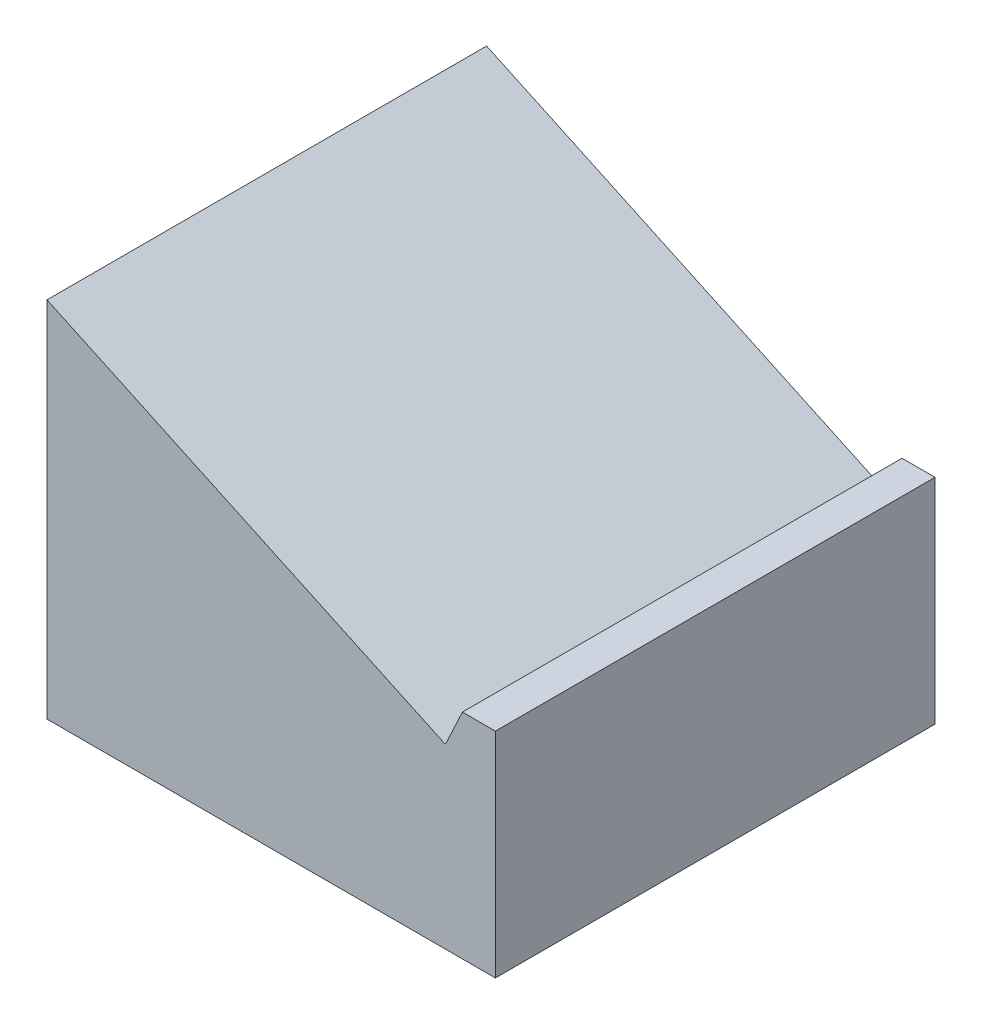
SolidWorks part; units mm, degrees
ref_plane "Front Plane" through (0, 0, 0) normal (0, 0, 1) x (1, 0, 0)
ref_plane "Top Plane" through (0, 0, 0) normal (0, 1, 0) x (1, 0, 0)
ref_plane "Right Plane" through (0, 0, 0) normal (1, 0, 0) x (0, 0, -1)
sketch "Sketch1" plane through (0, 0, 0) normal (0, 0, 1) x (1, 0, 0)
  line L0 (-25.908, 20.9804) -> (-25.908, 0)
  line L1 (-25.908, 0) -> (0, 0)
  line L2 (0, 0) -> (0, 12.3535)
  line L3 (0, 12.3535) -> (-1.905, 12.3535)
  line L4 (-1.905, 12.3535) -> (-2.8878, 10.2459)
  line L5 (-2.8878, 10.2459) -> (-25.908, 20.9804)
  dimension "D1" = 25
  dimension "D2" = 20.9804
  dimension "D3" = 25.908
  dimension "D4" = 1.905
  dimension "D5" = 25.4
extrude "Extrude1" add sketch "Sketch1" along normal blind 25.4
